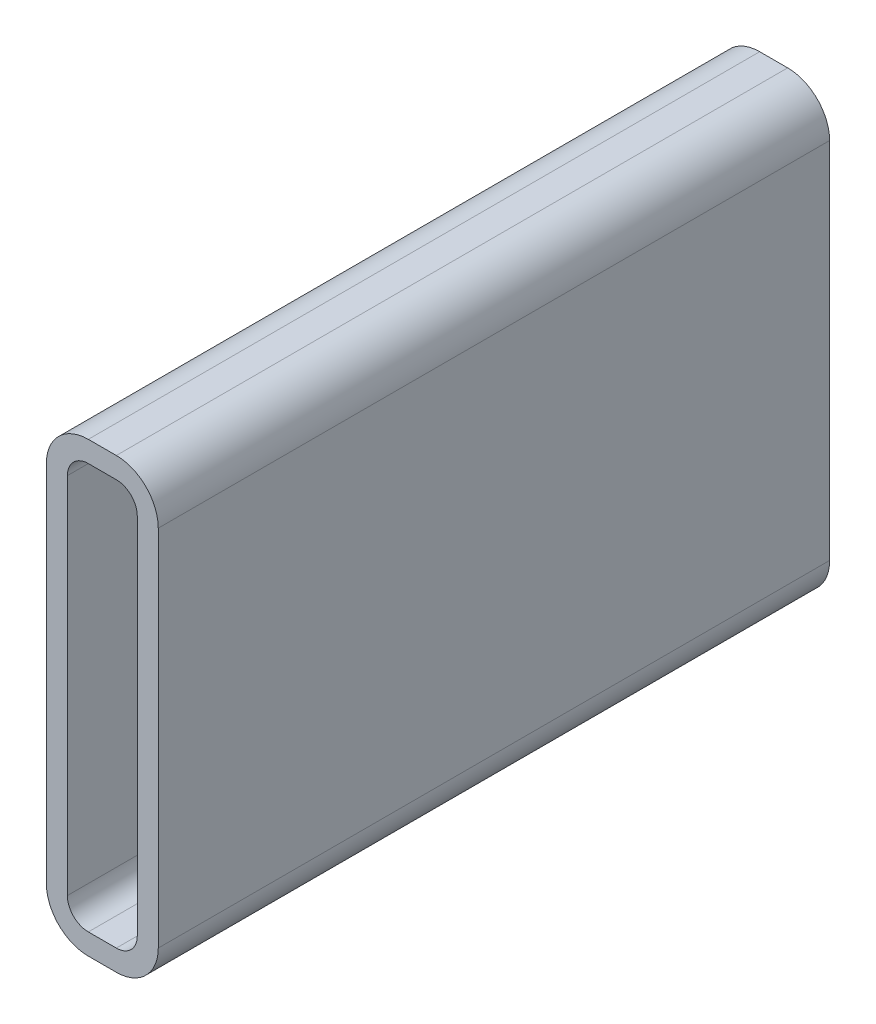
SolidWorks part; units mm, degrees
ref_plane "Front Plane" through (0, 0, 0) normal (0, 0, 1) x (1, 0, 0)
ref_plane "Top Plane" through (0, 0, 0) normal (0, 1, 0) x (1, 0, 0)
ref_plane "Right Plane" through (0, 0, 0) normal (1, 0, 0) x (0, 0, -1)
sketch "Sketch1" plane through (0, 0, 0) normal (0, 0, 1) x (1, 0, 0)
  line B0 (19.05, 203.2) -> (31.75, 203.2)
  arc B1 (50.8, 184.15) -> (31.75, 203.2) centre (31.75, 184.15) ccw
  line B2 (50.8, 184.15) -> (50.8, 19.05)
  arc B3 (31.75, 0) -> (50.8, 19.05) centre (31.75, 19.05) ccw
  line B4 (31.75, 0) -> (19.05, 0)
  arc B5 (0, 19.05) -> (19.05, 0) centre (19.05, 19.05) ccw
  line B6 (0, 19.05) -> (0, 184.15)
  arc B7 (19.05, 203.2) -> (0, 184.15) centre (19.05, 184.15) ccw
  line B8 (19.05, 193.675) -> (31.75, 193.675)
  arc B9 (41.275, 184.15) -> (31.75, 193.675) centre (31.75, 184.15) ccw
  line B10 (41.275, 184.15) -> (41.275, 19.05)
  arc B11 (31.75, 9.525) -> (41.275, 19.05) centre (31.75, 19.05) ccw
  line B12 (31.75, 9.525) -> (19.05, 9.525)
  arc B13 (9.525, 19.05) -> (19.05, 9.525) centre (19.05, 19.05) ccw
  line B14 (9.525, 19.05) -> (9.525, 184.15)
  arc B15 (19.05, 193.675) -> (9.525, 184.15) centre (19.05, 184.15) ccw
sketch_block_instance "HSS8x2x0.375-1"
sketch_block "HSS8x2x0.375"
extrude "Boss-Extrude1" add sketch "Sketch1" along normal blind 304.8
